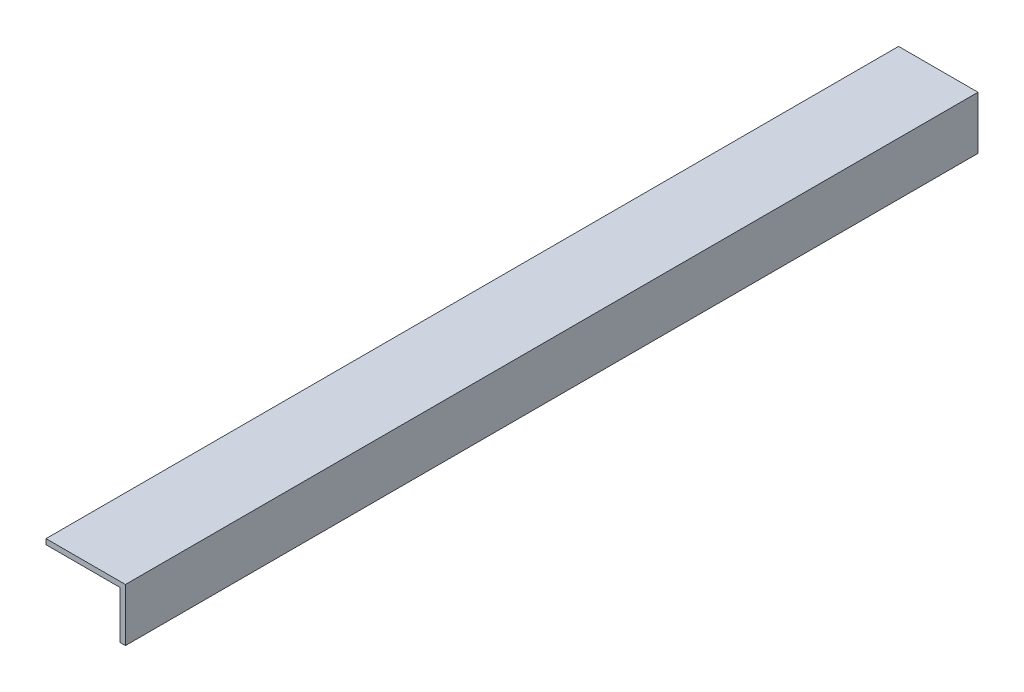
SolidWorks part; units mm, degrees
ref_plane "Front Plane" through (0, 0, 0) normal (0, 0, 1) x (1, 0, 0)
ref_plane "Top Plane" through (0, 0, 0) normal (0, 1, 0) x (1, 0, 0)
ref_plane "Right Plane" through (0, 0, 0) normal (1, 0, 0) x (0, 0, -1)
sketch "Sketch1" plane through (0, 0, 0) normal (0, 0, 1) x (1, 0, 0)
  line L1 (0, 0) -> (15, 0)
  line L2 (0, 0) -> (0, 10)
  line L3 (0, 10) -> (15, 10)
  line L4 (15, 0) -> (15, 10)
  dimension "D1" = 15
  dimension "D2" = 10
extrude "Boss-Extrude1" add sketch "Sketch1" along normal blind 161
sketch "Sketch2" plane through (0, 0, 0) normal (0, 0, -1) x (-1, 0, 0)
  line L0 (-15, 10) -> (0, 10) construction
  line L1 (0, 0) -> (-14, 0)
  line L2 (0, 0) -> (0, 9)
  line L3 (0, 9) -> (-14, 9)
  line L4 (-14, 0) -> (-14, 9)
  line L5 (-15, 0) -> (-15, 10) construction
  dimension "D1" = 1
  dimension "D2" = 1
extrude "Cut-Extrude1" cut sketch "Sketch2" against normal blind 161
